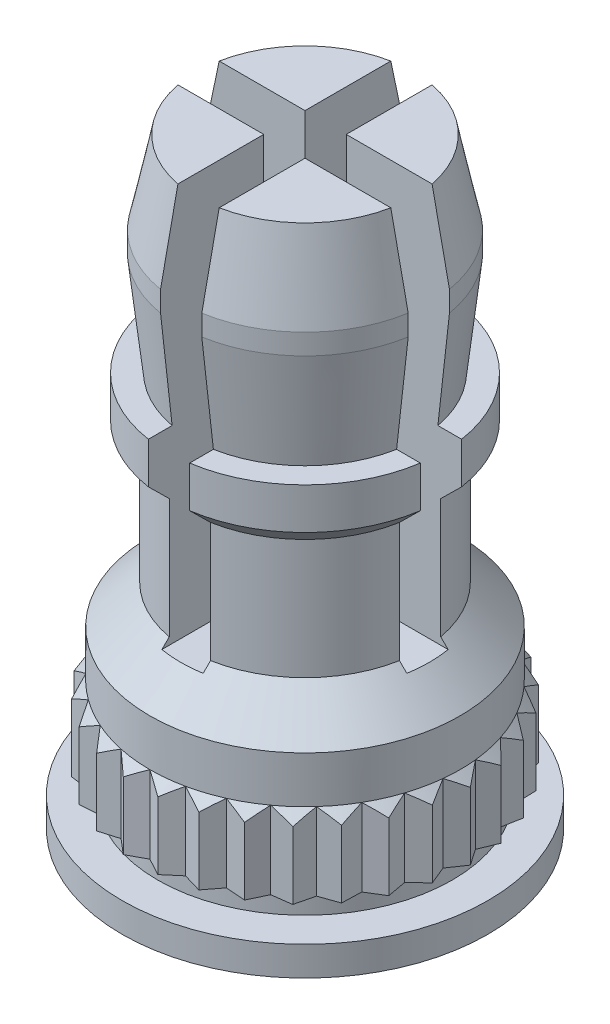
SolidWorks part; units mm, degrees
ref_plane "Plane1" through (0, 0, 0) normal (0, 0, 1) x (1, 0, 0)
ref_plane "Plane2" through (0, 0, 0) normal (0, 1, 0) x (1, 0, 0)
ref_plane "Plane3" through (0, 0, 0) normal (1, 0, 0) x (0, 0, -1)
sketch "BodySke" plane through (0, 0, 0) normal (0, 0, 1) x (1, 0, 0)
  line L0 (2.5578, 0) -> (2.5578, 0.381)
  line L1 (2.6924, 2.5354) -> (2.0295, 3.1984)
  line L2 (2.8702, 1.5494) -> (2.6924, 1.7272)
  line L3 (2.0295, 3.1984) -> (2.0295, 5.2756)
  line L4 (0, -0.508) -> (3.175, -0.508)
  line L5 (3.175, -0.508) -> (3.175, 0)
  line L6 (3.175, 0) -> (2.5578, 0)
  line L7 (2.3876, 5.6337) -> (2.3876, 6.35)
  line L8 (2.6924, 1.7272) -> (2.6924, 2.5354)
  line L9 (0, -0.508) -> (0, 17.145) construction
  line L10 (2.3876, 6.35) -> (1.9812, 6.35)
  line L11 (1.9812, 6.35) -> (2.1793, 8.1407)
  line L12 (2.1793, 8.1407) -> (2.1793, 8.4988)
  line L13 (2.1793, 8.4988) -> (1.8821, 9.9314)
  line L14 (1.8821, 9.9314) -> (0, 9.9314)
  line L15 (2.5578, 0.381) -> (2.8702, 0.381)
  line L16 (2.8702, 0.381) -> (2.8702, 1.5494)
  line L17 (0, 9.9314) -> (0, -0.508)
  line L19 (2.3876, 5.6337) -> (2.0295, 5.2756)
  dimension "H_dia" = 6.35
  dimension "D4" = 45
  dimension "T_ht" = 0.508
  dimension "Clinch_dia" = 5.7404
  dimension "C_dia" = 5.3848
  dimension "Groove_dia" = 5.1156
  dimension "Groove_wid" = 0.381
  dimension "Clinch_lim" = 1.3462
  dimension "Length" = 6.35
  dimension "D_ht" = 3.5814
  dimension "Neck_dia" = 4.0589
  dimension "B_dia" = 4.7752
  dimension "B_ht" = 0.7163
  dimension "Panel_dia" = 3.9624
  dimension "Slip_dia" = 4.3586
  dimension "Tip_dia" = 3.7643
  dimension "Grip_ht" = 1.7907
  dimension "Slip_ht" = 0.3581
  dimension "Neck_len" = 3.1516
revolve "Body" add sketch "BodySke" angle 360 about L9
sketch "SlitCutSke" plane through (0, 9.9314, 0) normal (0, 1, 0) x (-1, 0, 0)
  line L0 (-2.6685, 0.3581) -> (2.6685, 0.3581)
  line L1 (2.6685, -0.3581) -> (-2.6685, -0.3581)
  line L2 (-2.6685, 0.3581) -> (-2.6685, -0.3581)
  line L3 (2.6685, 0.3581) -> (2.6685, -0.3581)
  line L4 (-4.064, 0) -> (4.064, 0) construction
  circle A1 centre (0, 0) radius 2.6924 construction
  dimension "Width" = 0.7163
extrude "SlitCut" cut sketch "SlitCutSke" against normal blind 6.86
pattern_circular "SlitCutPat" count 2 every 90 about axis through (0, -0.508, 0) along (0, 1, 0) of "SlitCut"
ref_plane "Plane4" through (0, -0.5486, 0) normal (0, 1, 0) x (-1, 0, 0)
sketch "CliRinCutSke" plane through (0, 0.381, 0) normal (0, -1, 0) x (1, 0, 0)
  line L0 (0.3, 2.8545) -> (0, 2.6924)
  line L1 (0, 2.6924) -> (-0.3, 2.8545)
  line L2 (0, 0) -> (0, 5.842) construction
  arc A1 (0.3, 2.8545) -> (-0.3, 2.8545) centre (0, 0) ccw
  circle A2 centre (0, 0) radius 2.6924 construction
  dimension "Clinch_dia" = 5.7404
  dimension "Clinch_minor" = 5.3848
  dimension "Angle" = 12
extrude "ClinchCut" cut sketch "CliRinCutSke" against normal blind 1.3462
pattern_circular "ClinchCutPat" count 30 every 12 about axis through (0, -0.508, 0) along (0, 1, 0) of "ClinchCut"
equation "' \"Panel_dia@BodySke\" = 0.156"
equation "' \"Length@BodySke\" = 0.25"
equation "' \"B_dia@BodySke\" = 0.188"
equation "' \"C_dia@BodySke\" = 0.212"
equation "' \"D_ht@BodySke\" = 0.141"
equation "' \"H_dia@BodySke\" = 0.25"
equation "' \"T_ht@BodySke\" = 0.02"
equation "' \"Clinch_dia@BodySke\" = 0.226"
equation "\"Tip_dia@BodySke\" = \"Panel_dia@BodySke\" * 0.95"
equation "\"Slip_dia@BodySke\" = \"Panel_dia@BodySke\" * 1.1"
equation "\"Slip_ht@BodySke\" = \"D_ht@BodySke\" * 0.1"
equation "\"Grip_ht@BodySke\" = \"D_ht@BodySke\" * 0.5"
equation "\"B_ht@BodySke\" = \"B_dia@BodySke\" * 0.15"
equation "\"Neck_dia@BodySke\" = \"B_dia@BodySke\" * 0.85"
equation "\"Neck_len@BodySke\" = \"B_dia@BodySke\" * 0.66"
equation "\"Groove_dia@BodySke\" = \"C_dia@BodySke\" * 0.95"
equation "\"Groove_wid@BodySke\" = \"T_ht@BodySke\" * 0.75"
equation "\"Width@SlitCutSke\" = \"B_ht@BodySke\""
equation "\"Depth@SlitCut\" = \"D_ht@BodySke\" + \"Neck_len@BodySke\" + 0.005"
equation "\"Clinch_lim@BodySke\" = \"C_dia@BodySke\" * 0.25"
equation "\"Count@ClinchCutPat\" = 30"
equation "\"Angle@ClinchCutPat\" = 360 / \"Count@ClinchCutPat\""
equation "\"Angle@CliRinCutSke\" = 360 / \"Count@ClinchCutPat\""
equation "\"Clinch_dia@CliRinCutSke\" = \"Clinch_dia@BodySke\""
equation "\"Clinch_minor@CliRinCutSke\" = \"C_dia@BodySke\""
equation "\"Depth@ClinchCut\" = \"Clinch_lim@BodySke\""
